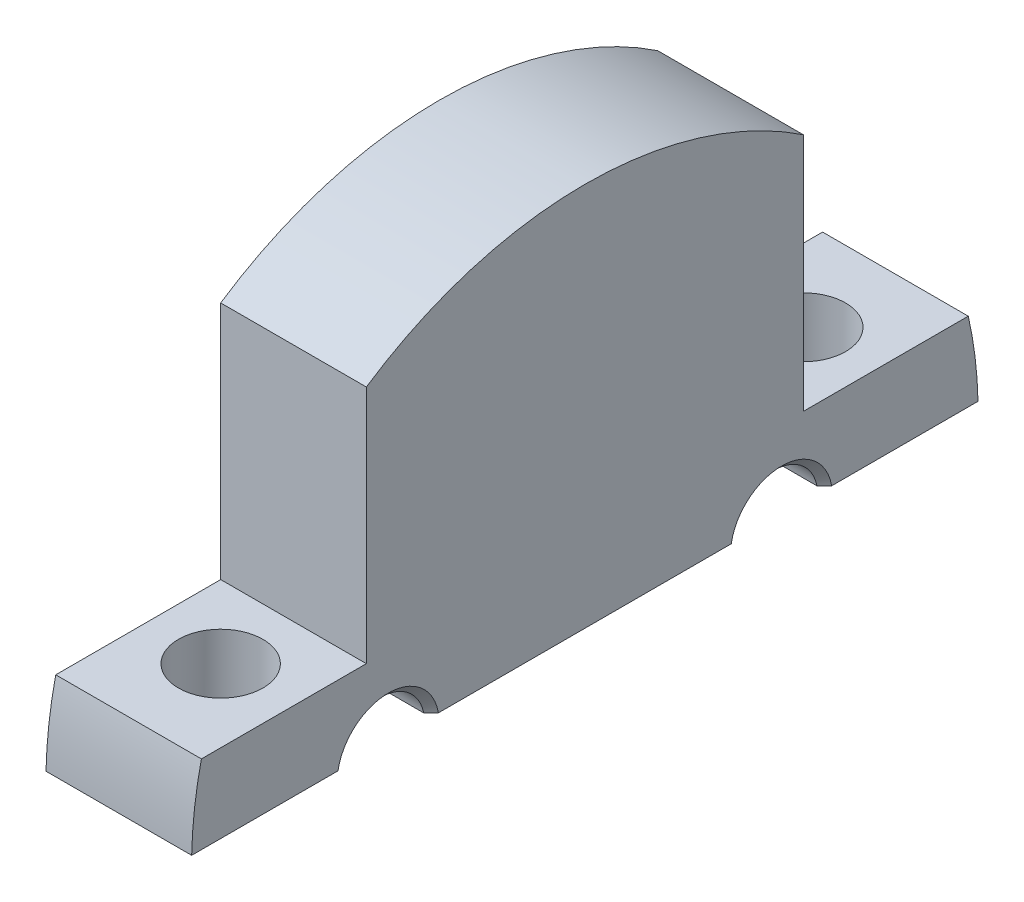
SolidWorks part; units mm, degrees
ref_plane "Vorne" through (0, 0, 0) normal (0, 0, 1) x (1, 0, 0)
ref_plane "Oben" through (0, 0, 0) normal (0, 1, 0) x (1, 0, 0)
ref_plane "Rechts" through (0, 0, 0) normal (1, 0, 0) x (0, 0, -1)
sketch "Skizze1" plane through (0, 0, 0) normal (0, 0, 1) x (1, 0, 0)
  line L0 (127.7, 0) -> (127.7, 13.5) construction
  line L1 (81.7, 13.5) -> (139.7, 13.5) construction
  line L2 (132.7, 13.5) -> (132.7, 8.65) construction
  line L3 (132.7, 8.65) -> (132.7, 0) construction
  line L4 (132.7, 0) -> (119.7, 0) construction
  line L5 (127.7, 0) -> (127.7, 13.5)
  line L6 (127.7, 13.5) -> (132.7, 13.5)
  line L7 (132.7, 13.5) -> (132.7, 8.65)
  line L8 (132.7, 8.65) -> (132.7, 0)
  line L9 (132.7, 0) -> (127.7, 0)
revolve "Rotation1" add sketch "Skizze1" angle 180 about L9
sketch "Skizze2" plane through (127.7, 0, 0) normal (-1, 0, 0) x (0, 0, 1)
  line L0 (-13.5, 0) -> (13.5, 0) construction
  line L1 (0, 0) -> (0, 3.0969) construction
  line L2 (-7.5, 11.225) -> (-7.5, 3)
  line L3 (-7.5, 3) -> (-13.1624, 3)
  line L4 (7.5, 11.225) -> (7.5, 3)
  line L5 (7.5, 3) -> (13.1624, 3)
  circle A0 centre (-6.75, 0) radius 1.5
  circle A1 centre (6.75, 0) radius 1.5
  arc A2 (13.5, 0) -> (-13.5, 0) centre (0, 0) ccw construction
  arc A3 (-7.5, 11.225) -> (-13.1624, 3) centre (0, 0) ccw
  arc A4 (7.5, 11.225) -> (13.1624, 3) centre (0, 0) cw
  dimension "D1" = 3
  dimension "D2" = 13.5
  dimension "D3" = 15
  dimension "D4" = 3
extrude "Schnitt-Linear austragen1" cut sketch "Skizze2" against normal through all
hole_wizard "Ø2.9 (2.9) Durchmesser Bohrung1" positions "Skizze4" profile "Skizze3" hole size "Ø2.9" standard "ISO"
sketch "Skizze4" plane through (0, 3, 0) normal (0, 1, 0) x (-1, 0, 0)
  line L0 (-148.8824, 0) -> (-143.9282, 0) construction
  line L2 (-127.7, 10) -> (-132.7, 10) construction
  line L3 (-127.7, 7.5) -> (-127.7, 13.1624) construction
  line L4 (-132.7, 7.5) -> (-132.7, 13.1624) construction
  point P0 (-130.2, 10)
  point P1 (-130.2, -10)
  dimension "D1" = 20
sketch "Skizze3" plane through (130.2, 3, 10) normal (1, 0, 0) x (0, 0, 1)
  line L0 (0, 0) -> (0, 3)
  line L1 (0, 3) -> (1.45, 3)
  line L2 (1.45, 3) -> (1.45, 0)
  line L5 (1.45, 0) -> (0, 0)
  line L11 (0, -6.35) -> (0, 107.95) construction
  dimension "Bohrerdurchmesser" = 2.9
  dimension "Bohrungstiefe" = 3
chamfer "Fase1" distance 0.25 angle 45 4 edges at (127.7, 1.5, -6.75) (127.7, 1.5, 6.75) (132.7, 1.5, 6.75) (132.7, 1.5, -6.75)
sketch "Skizze5" plane through (127.7, 0, 0) normal (-1, 0, 0) x (0, 0, 1)
  line L1 (-13.5, 0) -> (13.5, 0)
  line L2 (-13.5, 0) -> (-13.5, 0.3)
  line L3 (-13.5, 0.3) -> (13.5, 0.3)
  line L4 (13.5, 0) -> (13.5, 0.3)
  arc A0 (13.5, 0) -> (13.1624, 3) centre (0, 0) ccw construction
  dimension "D1" = 0.3
extrude "Schnitt-Linear austragen2" cut sketch "Skizze5" against normal through all
